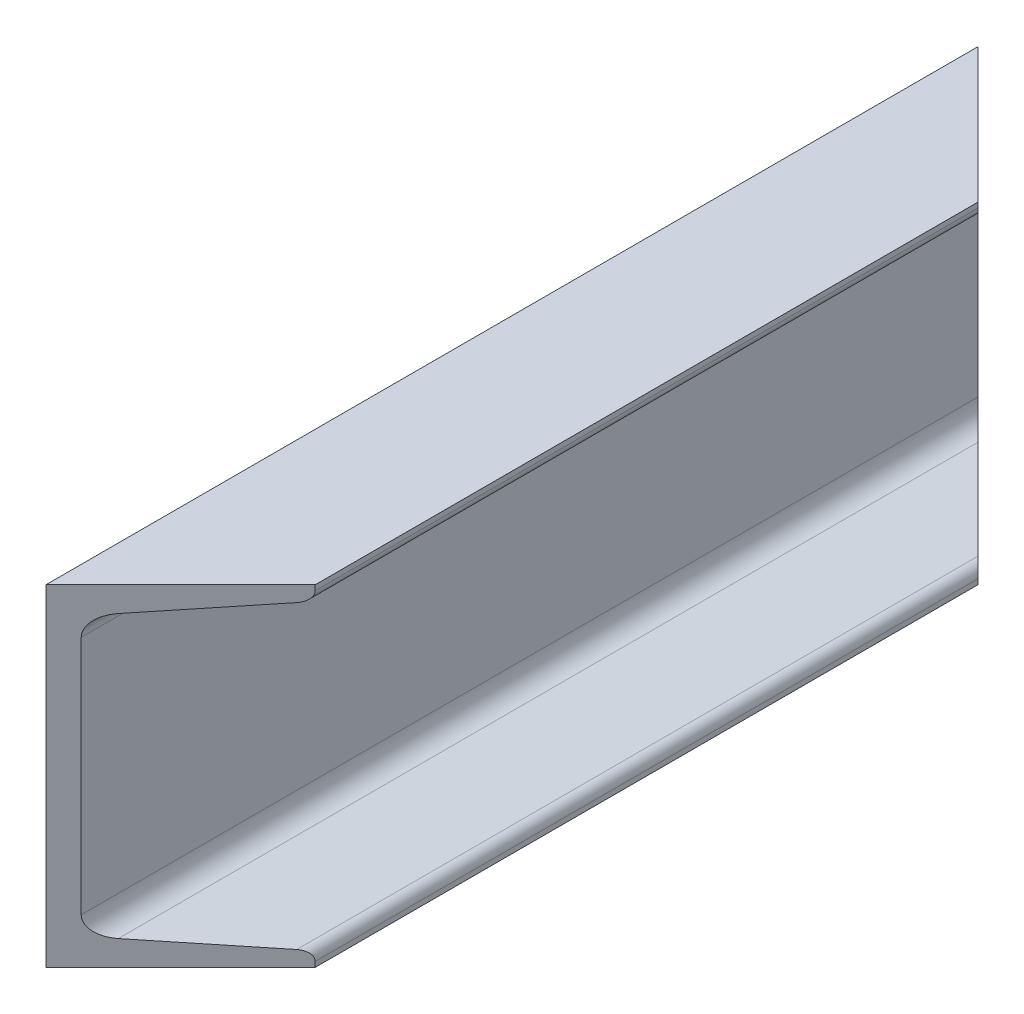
SolidWorks part; units mm, degrees
ref_plane "前视基准面" through (0, 0, 0) normal (0, 0, 1) x (1, 0, 0)
ref_plane "上视基准面" through (0, 0, 0) normal (0, 1, 0) x (1, 0, 0)
ref_plane "右视基准面" through (0, 0, 0) normal (1, 0, 0) x (0, 0, -1)
sketch "草图1" plane through (0, 0, 0) normal (0, 0, 1) x (1, 0, 0)
  line L0 (0, 80) -> (0, -80)
  line L1 (0, -80) -> (65, -80)
  line L2 (65, -80) -> (65, -77.4971)
  line L3 (60.528, -72.5251) -> (17.444, -67.9498)
  line L4 (8.5, -58.0057) -> (8.5, 58.0057)
  line L5 (17.444, 67.9498) -> (60.528, 72.5251)
  line L6 (65, 77.4971) -> (65, 80)
  line L7 (65, 80) -> (0, 80)
  line L8 (36.75, 80) -> (36.75, 70) construction
  line L9 (36.75, -70) -> (36.75, -80) construction
  arc A0 (8.5, 58.0057) -> (17.444, 67.9498) centre (18.5, 58.0057) cw
  arc A1 (17.444, -67.9498) -> (8.5, -58.0057) centre (18.5, -58.0057) cw
  arc A2 (60.528, 72.5251) -> (65, 77.4971) centre (60, 77.4971) ccw
  arc A3 (65, -77.4971) -> (60.528, -72.5251) centre (60, -77.4971) ccw
  point P19 (65, 73)
  point P22 (65, -73)
  dimension "D10" = 10
  dimension "D11" = 5
  dimension "D1" = 160
  dimension "D2" = 7
  dimension "D3" = 65
  dimension "D4" = 65
  dimension "D5" = 8.5
  dimension "D6" = 7
  dimension "D7" = 28.25
  dimension "D8" = 10
  dimension "D9" = 10
extrude "拉伸1" add sketch "草图1" along normal mid plane 450
sketch "草图2" plane through (0, 80, 0) normal (0, 1, 0) x (-1, 0, 0)
  line L0 (-65, 225) -> (-65, 160)
  line L1 (-65, 225) -> (-65, -225) construction
  line L3 (-65, 160) -> (0, 225)
  line L4 (0, 225) -> (-65, 225)
  line L5 (-65, -225) -> (-65, -160)
  line L6 (-65, -160) -> (0, -225)
  line L7 (0, -225) -> (-65, -225)
  dimension "D1" = 45
  dimension "D2" = 45
extrude "切除-拉伸1" cut sketch "草图2" against normal blind 500
